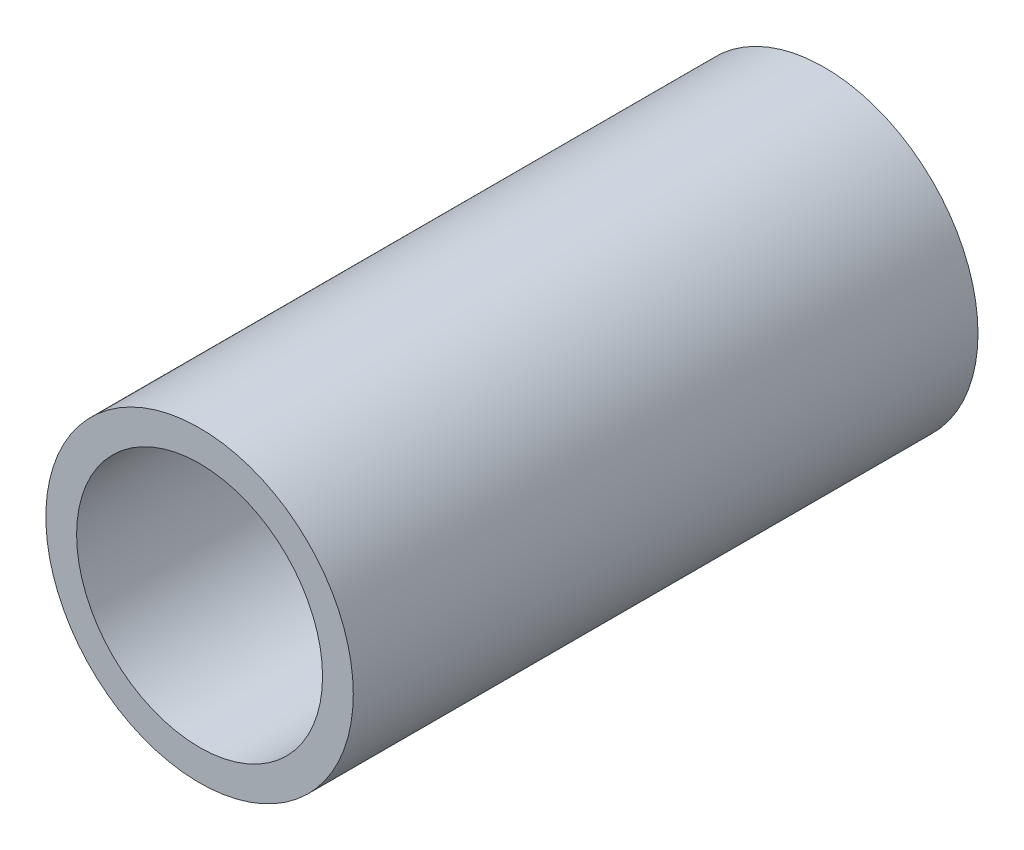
SolidWorks part; units mm, degrees
ref_plane "Front Plane" through (0, 0, 0) normal (0, 0, 1) x (1, 0, 0)
ref_plane "Top Plane" through (0, 0, 0) normal (0, 1, 0) x (1, 0, 0)
ref_plane "Right Plane" through (0, 0, 0) normal (1, 0, 0) x (0, 0, -1)
sketch "Sketch1" plane through (0, 0, 0) normal (0, 0, 1) x (1, 0, 0)
  circle A0 centre (0, 0) radius 5
  circle A1 centre (0, 0) radius 6.25
  dimension "D1" = 12.5
  dimension "D2" = 10
extrude "Boss-Extrude1" add sketch "Sketch1" along normal blind 25.4
